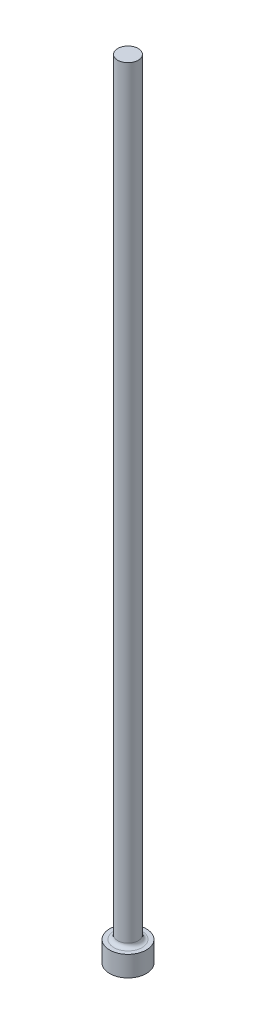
SolidWorks part; units mm, degrees
ref_plane "Front Plane" through (0, 0, 0) normal (0, 0, 1) x (1, 0, 0)
ref_plane "Top Plane" through (0, 0, 0) normal (0, 1, 0) x (1, 0, 0)
ref_plane "Right Plane" through (0, 0, 0) normal (1, 0, 0) x (0, 0, -1)
sketch "Sketch1" plane through (0, 0, 0) normal (0, 0, 1) x (1, 0, 0)
  line L0 (0, 0) -> (3.556, 0)
  line L1 (55, 0) -> (-55, 0) construction
  line L2 (3.556, 0) -> (3.556, 3.9624)
  line L3 (3.556, 3.9624) -> (2.7457, 3.9624)
  line L4 (1.9837, 4.7244) -> (1.9837, 152.4)
  line L5 (1.9837, 152.4) -> (0, 152.4)
  line L6 (0, 152.4) -> (0, 0)
  arc A0 (2.7457, 3.9624) -> (1.9837, 4.7244) centre (2.7457, 4.7244) cw
  dimension "D5" = 0.762
  dimension "D1" = 1.9837
  dimension "D2" = 3.556
  dimension "D3" = 3.9624
  dimension "D4" = 152.4
revolve "Revolve1" add sketch "Sketch1" angle 360 about L6
